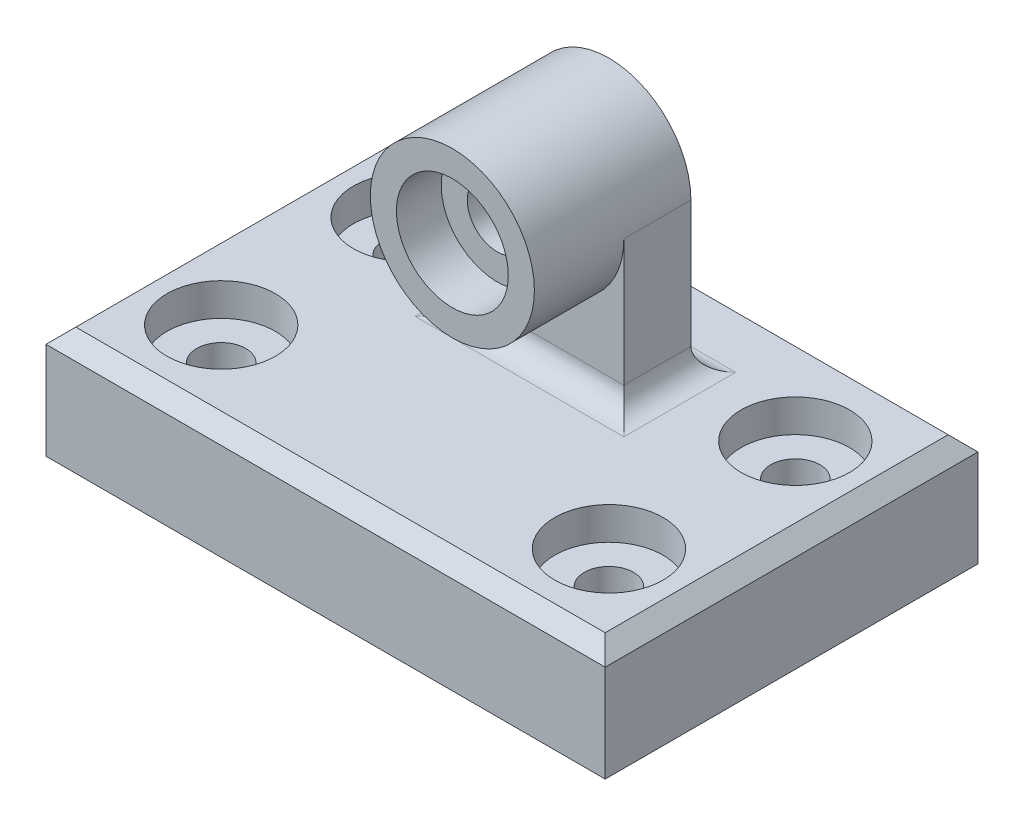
SolidWorks part; units mm, degrees
ref_plane "Front Plane" through (0, 0, 0) normal (0, 0, 1) x (1, 0, 0)
ref_plane "Top Plane" through (0, 0, 0) normal (0, 1, 0) x (1, 0, 0)
ref_plane "Right Plane" through (0, 0, 0) normal (1, 0, 0) x (0, 0, -1)
sketch "Sketch1" plane through (0, 0, 0) normal (0, 1, 0) x (1, 0, 0)
  line L1 (-37.5, 25) -> (37.5, 25)
  line L2 (-37.5, 25) -> (-37.5, -25)
  line L3 (-37.5, -25) -> (37.5, -25)
  line L4 (37.5, 25) -> (37.5, -25)
  line L5 (-37.5, 25) -> (37.5, -25) construction
  line L6 (-37.5, -25) -> (37.5, 25) construction
  point P0 (0, 0)
  dimension "D1" = 75
  dimension "D2" = 50
extrude "BASE" add sketch "Sketch1" along normal blind 15
sketch "Sketch3" plane through (0, 0, 0) normal (0, 1, 0) x (1, 0, 0)
  line L0 (37.5, 25) -> (-37.5, 25) construction
  line L1 (-11, 4) -> (11, 4)
  line L2 (-11, 4) -> (-11, 13)
  line L3 (-11, 13) -> (11, 13)
  line L4 (11, 4) -> (11, 13)
  dimension "D1" = 9
  dimension "D2" = 22
  dimension "D3" = 11
  dimension "D4" = 12
extrude "PILLAR" add sketch "Sketch3" along normal blind 35
sketch "Sketch4" plane through (0, 0, -13) normal (0, 0, -1) x (-1, 0, 0)
  line L0 (11, 35) -> (-11, 35) construction
  circle A0 centre (0, 35) radius 11
  dimension "D1" = 22
extrude "BOSS" add sketch "Sketch4" against normal blind 21
sketch "Sketch5" plane through (0, 0, 8) normal (0, 0, 1) x (1, 0, 0)
  circle A0 centre (0, 35) radius 4
  dimension "D1" = 8
extrude "BOSS_HOLE" cut sketch "Sketch5" against normal up to next
sketch "Sketch6" plane through (0, 0, 8) normal (0, 0, 1) x (1, 0, 0)
  circle A0 centre (0, 35) radius 7.5
  dimension "D1" = 15
extrude "BOSS_CounterSink" cut sketch "Sketch6" against normal blind 6
hole_wizard "CBORE for M6 Hex Head Bolt1" positions "Sketch7" profile "Sketch8" counterbore size "M6" standard "ANSI Metric"
sketch "Sketch7" plane through (0, 15, 0) normal (0, 1, 0) x (1, 0, 0)
  line L0 (37.5, 25) -> (-37.5, 25) construction
  point P0 (-26, -13)
  dimension "D1" = 38
  dimension "D4" = 26
sketch "Sketch8" plane through (-26, 15, 13) normal (1, 0, 0) x (0, 0, 1)
  line L0 (0, 0) -> (0, 15)
  line L1 (0, 15) -> (3.3, 15)
  line L3 (3.3, 15) -> (3.3, 4.38)
  line L4 (3.3, 4.38) -> (7.275, 4.38)
  line L5 (7.275, 4.38) -> (7.275, 0)
  line L7 (7.275, 0) -> (0, 0)
  line L11 (0, -6.35) -> (0, 107.95) construction
  dimension "Thru Hole Dia." = 6.6
  dimension "Thru Hole Depth" = 15
  dimension "C'Bore Dia." = 14.55
  dimension "C'Bore Depth" = 4.38
chamfer "Chamfer1" distance 2 angle 45 4 edges at (37.5, 15, 0) (0, 15, 25) (0, 15, -25) (-37.5, 15, 0)
fillet "Fillet2" radius 3 4 edges at (-11, 15, -8.5) (0, 15, -13) (11, 15, -8.5) (0, 15, -4)
pattern_linear "LPattern1" count 2 spacing 52 along (1, 0, 0) count 2 spacing 25 along (0, 0, -1) of "CBORE for M6 Hex Head Bolt1"
